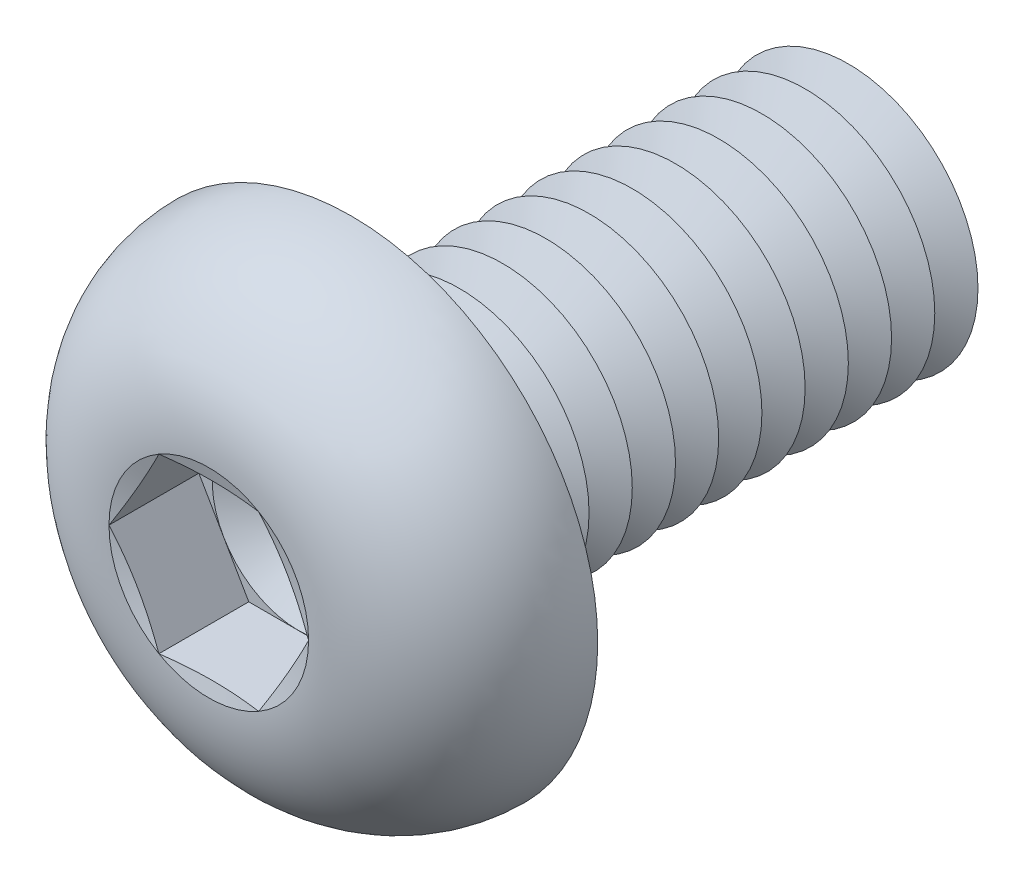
SolidWorks part; units mm, degrees
ref_plane "Front Plane" through (0, 0, 0) normal (0, 0, 1) x (1, 0, 0)
ref_plane "Top Plane" through (0, 0, 0) normal (0, 1, 0) x (1, 0, 0)
ref_plane "Right Plane" through (0, 0, 0) normal (1, 0, 0) x (0, 0, -1)
sketch "Sketch1" plane through (0, 0, 0) normal (1, 0, 0) x (0, 0, -1)
  line L0 (0, 1.5) -> (0, 2.85)
  line L3 (0, 1.5) -> (6, 1.5)
  line L4 (6, 1.5) -> (6, 0)
  line L5 (6, 0) -> (-1.65, 0) construction
  line L6 (-1.65, 0) -> (6, 0)
  line L7 (-1.65, 1.1547) -> (-1.65, 0.5773) construction
  line L8 (-1.65, 0.5773) -> (-1.65, 0)
  line L9 (-1.65, 1.1547) -> (-1.4953, 0.5773)
  line L10 (-1.4953, 0.5773) -> (-1.65, 0.5773)
  line L11 (6, 0) -> (22.7481, 0) construction
  line L12 (0, 2.85) -> (-1.65, 2.85) construction
  arc A1 (0, 2.85) -> (-1.65, 1.1547) centre (0, 1.1994) ccw
  point P8 (6, 0.75)
  dimension "D1" = 5.7
  dimension "D2" = 3
  dimension "D3" = 1.65
  dimension "D4" = 2.3094
  dimension "D5" = 6
  dimension "D6" = 15
revolve "Revolve1" add sketch "Sketch1" angle 360 about L5
fillet "Fillet1" radius 0.25 1 edges at (-1.5, 0, 0)
sketch "Sketch2" plane through (0, 0, 0) normal (1, 0, 0) x (0, 0, -1)
  line L0 (5.75, 1.5) -> (6.25, 1.5)
  line L1 (6, 1.5) -> (0.25, 1.5) construction
  line L2 (6.25, 1.5) -> (6, 1.067)
  line L3 (6, -1.5) -> (6, 1.5) construction
  line L4 (6, 1.067) -> (5.75, 1.5)
  dimension "D1" = 0.5
revolve "Cut-Revolve1" cut sketch "Sketch2" angle 360 about axis through (0, 0, -6) along (0, 0, -1)
pattern_linear "LPattern1" count 12 spacing 0.5 along (0, 0, 1) of "Cut-Revolve1"
sketch "Sketch3" plane through (0, 0, 1.65) normal (0, 0, 1) x (1, 0, 0)
  line L7 (0.5773, 1) -> (-0.5774, 1)
  line L8 (-0.5774, 1) -> (-1.1547, 0)
  line L9 (-1.1547, 0) -> (-0.5773, -1)
  line L10 (-0.5773, -1) -> (0.5773, -1)
  line L11 (0.5773, -1) -> (1.1547, 0)
  line L12 (1.1547, 0) -> (0.5773, 1)
  circle A0 centre (0, 0) radius 1 construction
  circle A3 centre (0, 0) radius 1.1547 construction
extrude "Cut-Extrude1" cut sketch "Sketch3" against normal blind 1.04
sketch "Sketch4" plane through (0, 0, 0.61) normal (0, 0, 1) x (1, 0, 0)
  line L1 (0.5773, 1) -> (-0.5774, 1) construction
  circle A0 centre (0, 0) radius 1
extrude "Cut-Extrude2" cut sketch "Sketch4" against normal through all draft 60
